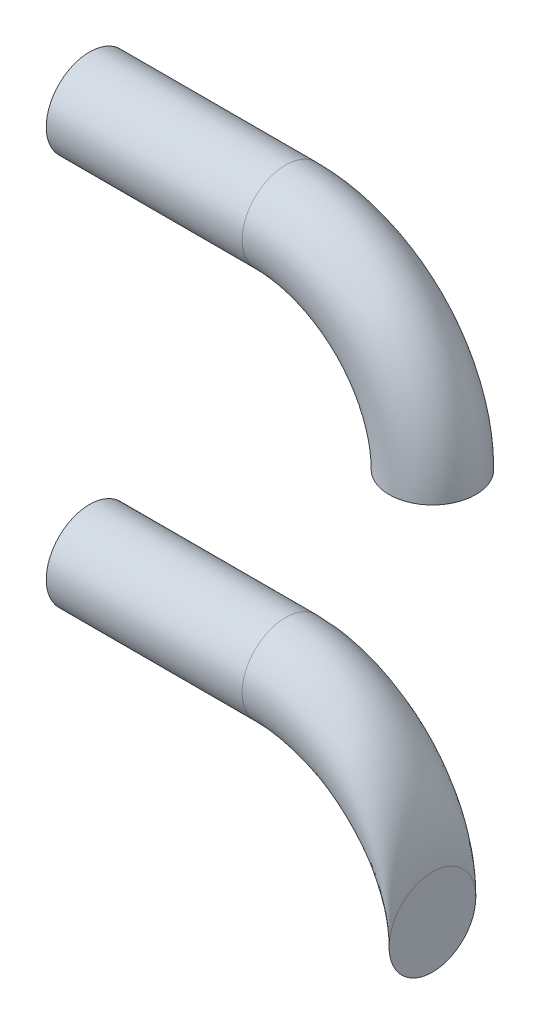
SolidWorks part; units mm, degrees
ref_plane "Front Plane" through (0, 0, 0) normal (0, 0, 1) x (1, 0, 0)
ref_plane "Top Plane" through (0, 0, 0) normal (0, 1, 0) x (1, 0, 0)
ref_plane "Right Plane" through (0, 0, 0) normal (1, 0, 0) x (0, 0, -1)
sketch "Sketch1" plane through (0, 0, 0) normal (0, 0, 1) x (1, 0, 0)
  line L0 (0, 0) -> (101.6, 0)
  arc A0 (101.6, 0) -> (177.8, -76.2) centre (101.6, -76.2) cw
  dimension "D2" = 76.2
  dimension "D1" = 101.6
sketch "Sketch2" plane through (0, 0, 0) normal (1, 0, 0) x (0, 0, -1)
  circle A0 centre (0, 0) radius 22.4912
sweep "Sweep1" add profiles "Sketch2" path "Sketch1"
sketch "Sketch3" plane through (0, 0, 0) normal (0, 0, 1) x (1, 0, 0)
  line L0 (0, -203.2) -> (101.6, -203.2)
  line L1 (0, 0) -> (101.6, 0) construction
  arc A0 (101.6, -203.2) -> (177.8, -279.4) centre (101.6, -279.4) cw
  arc A1 (177.8, -76.2) -> (101.6, 0) centre (101.6, -76.2) ccw construction
  dimension "D1" = 203.2
sketch "Sketch4" plane through (0, 0, 0) normal (1, 0, 0) x (0, 0, -1)
  circle A0 centre (0, -203.2) radius 22.4912
  circle A1 centre (0, 0) radius 22.4912 construction
sweep "Sweep2" add profiles "Sketch4" path "Sketch3"
